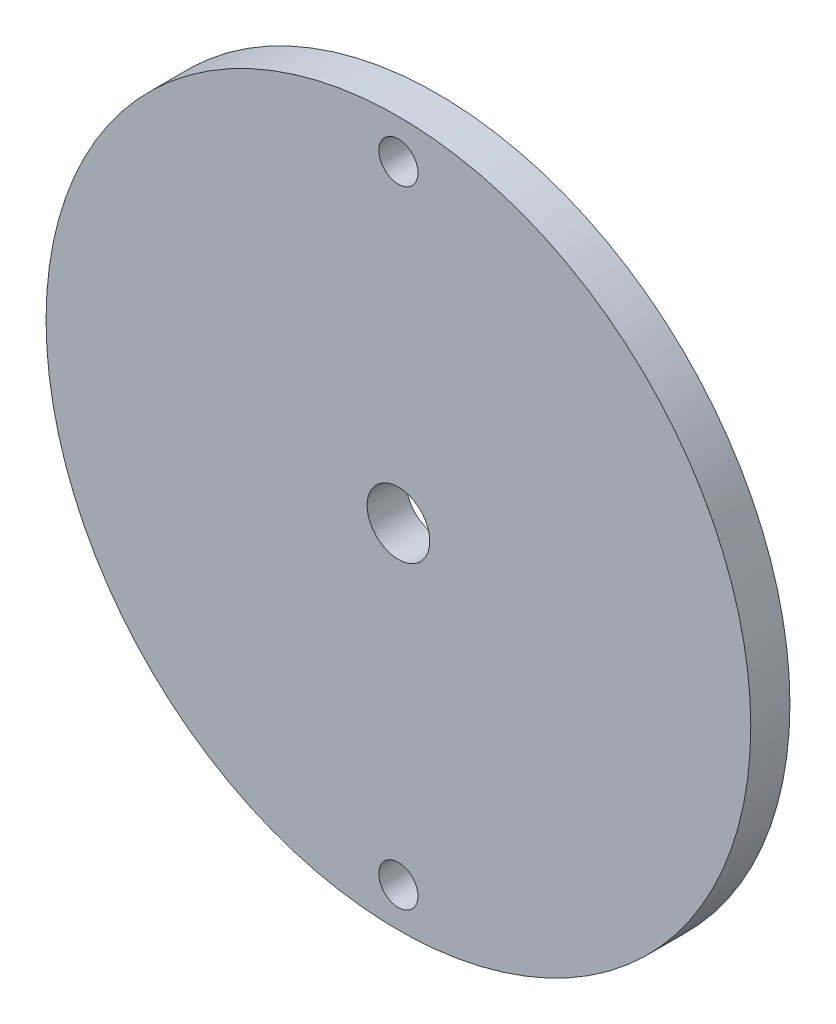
SolidWorks part; units mm, degrees
ref_plane "前视基准面" through (0, 0, 0) normal (0, 0, 1) x (1, 0, 0)
ref_plane "上视基准面" through (0, 0, 0) normal (0, 1, 0) x (1, 0, 0)
ref_plane "右视基准面" through (0, 0, 0) normal (1, 0, 0) x (0, 0, -1)
other "Configuration Table"
sketch "草图1" plane through (0, 0, 0) normal (0, 0, 1) x (1, 0, 0)
  circle A1 centre (0, 0) radius 4
extrude "凸台-拉伸1" add sketch "草图1" along normal blind 70
sketch "草图2" plane through (0, 0, 70) normal (0, 0, 1) x (1, 0, 0)
  circle A0 centre (0, 0) radius 75
  dimension "D1" = 150
extrude "凸台-拉伸2" add sketch "草图2" against normal blind 5
sketch "草图5" plane through (0, 0, 0) normal (0, 0, -1) x (-1, 0, 0)
  circle A0 centre (0, 0) radius 45
  dimension "D1" = 90
extrude "凸台-拉伸3" add sketch "草图5" against normal blind 5 from offset 30
sketch "草图6" plane through (0, 0, 30) normal (0, 0, -1) x (-1, 0, 0)
  circle A0 centre (0, 0) radius 40 construction
  circle A1 centre (0, 40) radius 2.5
  dimension "D1" = 80
  dimension "D2" = 5
extrude "切除-拉伸1" cut sketch "草图6" against normal blind 100
mirror "镜向1" about plane through (0, 0, 0) normal (0, 1, 0) of "切除-拉伸1"
sketch "草图15" plane through (0, 0, 70) normal (0, 0, 1) x (1, 0, 0)
  circle A0 centre (0, 0) radius 153.2302
extrude "切除-拉伸7" cut sketch "草图15" against normal up to surface (35 mm away)
sketch "草图16" plane through (0, 0, 0) normal (0, 0, -1) x (-1, 0, 0)
  circle A1 centre (0, 0) radius 4
  circle A2 centre (0, 0) radius 4
  dimension "D1" = 0
extrude "切除-拉伸8" cut sketch "草图16" against normal blind 88
